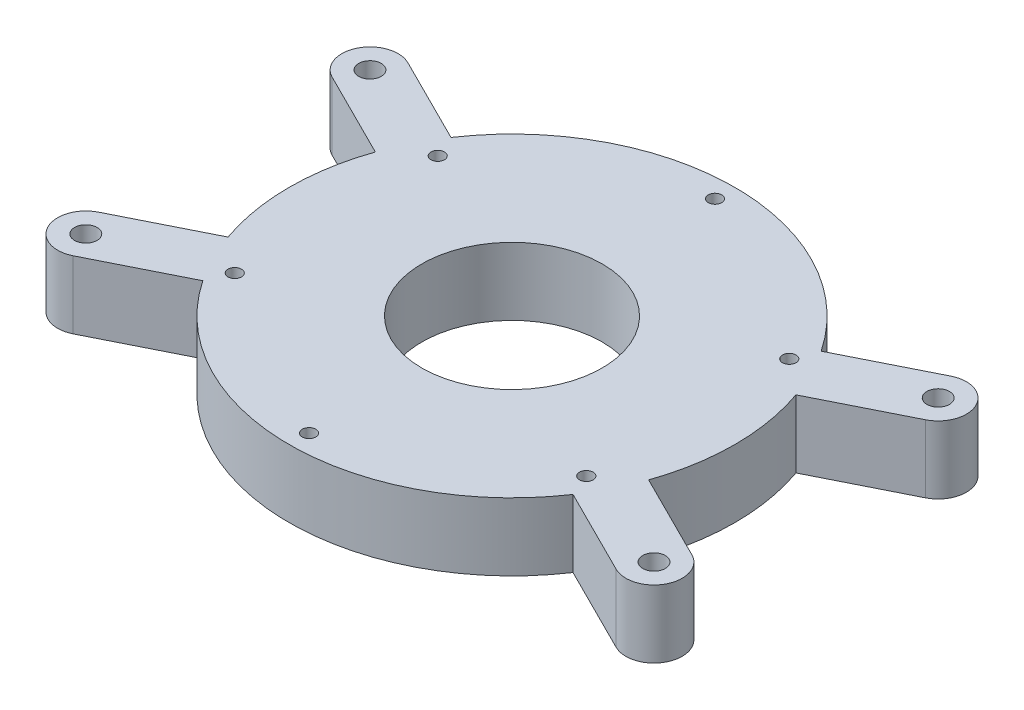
SolidWorks part; units mm, degrees
ref_plane "前视基准面" through (0, 0, 0) normal (0, 0, 1) x (1, 0, 0)
ref_plane "上视基准面" through (0, 0, 0) normal (0, 1, 0) x (1, 0, 0)
ref_plane "右视基准面" through (0, 0, 0) normal (1, 0, 0) x (0, 0, -1)
sketch "草图1" plane through (0, 0, 0) normal (0, 1, 0) x (1, 0, 0)
  line L0 (65.782, 25.9101) -> (46.6233, 16.3287)
  line L1 (60.1908, 37.0899) -> (41.0322, 27.5085)
  line L2 (0, 135.0816) -> (0, -134.5462) construction
  line L3 (161.8892, 80.9621) -> (-87.1466, -43.5827) construction
  line L7 (-65.782, 25.9101) -> (-46.6233, 16.3287)
  line L8 (-50, 21.5) -> (50, 21.5) construction
  line L9 (-50, 21.5) -> (-50, -21.5) construction
  line L10 (-50, -21.5) -> (50, -21.5) construction
  line L11 (50, 21.5) -> (50, -21.5) construction
  line L12 (-60.1908, 37.0899) -> (-41.0322, 27.5085)
  line L13 (-133.256, 0) -> (145.6129, 0) construction
  line L14 (65.782, -25.9101) -> (46.6233, -16.3287)
  line L15 (60.1908, -37.0899) -> (41.0322, -27.5085)
  line L16 (-65.782, -25.9101) -> (-46.6233, -16.3287)
  line L17 (-60.1908, -37.0899) -> (-41.0322, -27.5085)
  circle A0 centre (0, 0) radius 20
  circle A1 centre (0, 0) radius 49.4
  circle A2 centre (62.9864, 31.5) radius 6.25
  circle A6 centre (-62.9864, 31.5) radius 6.25
  circle A7 centre (62.9864, -31.5) radius 6.25
  circle A8 centre (-62.9864, -31.5) radius 6.25
  point P19 (0, 21.5)
  point P20 (50, 0)
  point P41 (0, 0)
  dimension "D2" = 12.5
  dimension "D5" = 98.8
  dimension "D7" = 40
  dimension "D1" = 63.43
  dimension "D3" = 100
  dimension "D4" = 43
  dimension "D6" = 10
extrude "凸台-拉伸1" add sketch "草图1" along normal blind 15 contours A1 A0 | L12 A6 L7 A1 | A8 L17 A1 L16 | A8 | L15 A7 L14 A1 | A7 | A2 | A2 L1 A1 L0
sketch "草图2" plane through (0, 15, 0) normal (0, 1, 0) x (1, 0, 0)
  line L0 (0, 78.1952) -> (0, -57.2274) construction
  line L1 (-93.9988, 0) -> (82.0699, 0) construction
  circle A0 centre (-62.9864, 31.5) radius 2.5
  arc A1 (-60.1908, 37.0899) -> (-65.782, 25.9101) centre (-62.9864, 31.5) ccw construction
  dimension "D1" = 5
extrude "切除-拉伸1" cut sketch "草图2" against normal blind 10
mirror "镜向1" about plane through (0, 0, 0) normal (0, 0, 1) of "切除-拉伸1"
mirror "镜向2" about plane through (0, 0, 0) normal (1, 0, 0) of "镜向1", "切除-拉伸1"
ref_plane "基准面1" through (0, 7.5, 0) normal (0, -1, 0) x (-1, 0, 0)
sketch "草图3" plane through (0, 0, 0) normal (0, -1, 0) x (1, 0, 0)
  line L1 (-65.782, 25.9101) -> (-46.6233, 16.3287) construction
  circle A0 centre (-54.0425, 27.0271) radius 2.5
  circle A2 centre (-62.9864, 31.5) radius 2.0501 construction
  arc A3 (-60.1908, 37.0899) -> (-65.782, 25.9101) centre (-62.9864, 31.5) ccw construction
  dimension "D1" = 5
  dimension "D3" = 10
  dimension "D2" = 6.25
extrude "切除-拉伸2" cut sketch "草图3" against normal blind 10
mirror "镜向3" about plane through (0, 0, 0) normal (1, 0, 0) of "切除-拉伸2"
mirror "镜向4" about plane through (0, 0, 0) normal (0, 0, 1) of "镜向3", "切除-拉伸2"
sketch "草图4" plane through (0, 0, 0) normal (0, -1, 0) x (1, 0, 0)
  circle A0 centre (0, -45) radius 1.5
  dimension "D1" = 3
  dimension "D2" = 45
extrude "切除-拉伸3" cut sketch "草图4" against normal through all
pattern_circular "阵列(圆周)1" count 6 over 360 about axis through (0, 0, 0) along (0, 1, 0) of "切除-拉伸3"
